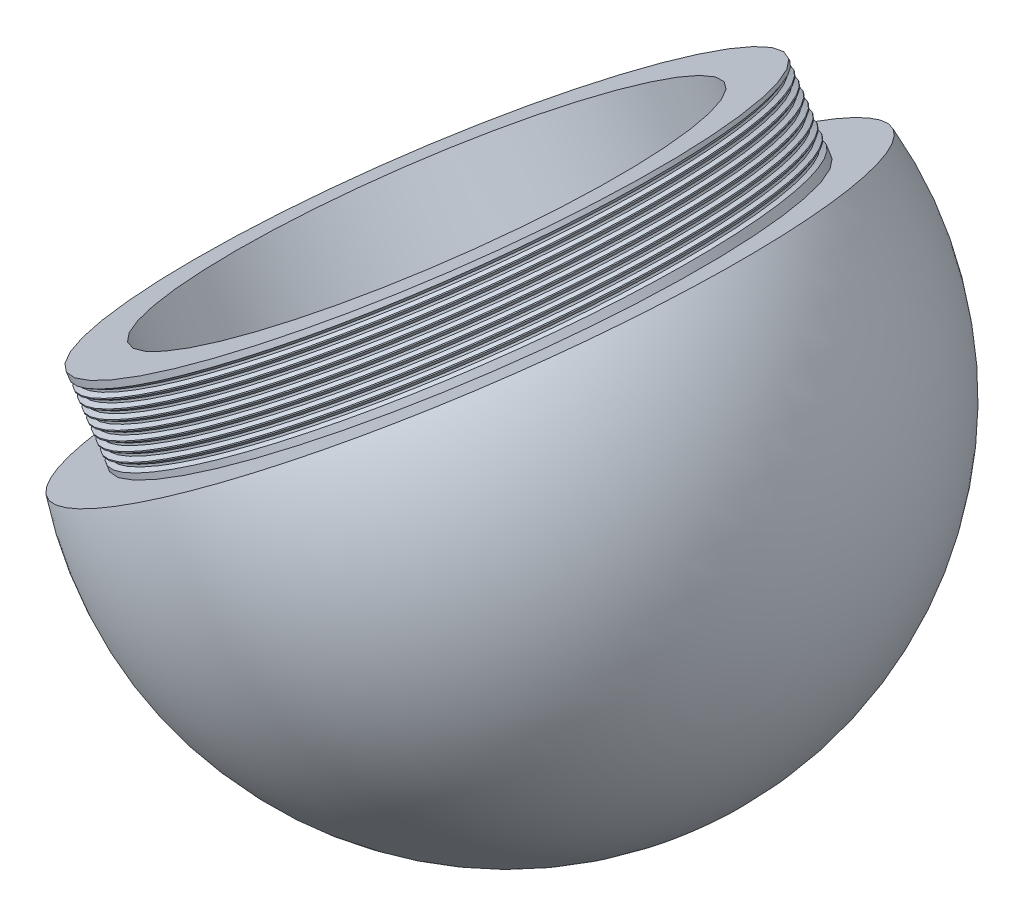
SolidWorks part; units mm, degrees
ref_plane "Płaszczyzna przednia" through (0, 0, 0) normal (0, 0, 1) x (1, 0, 0)
ref_plane "Płaszczyzna górna" through (0, 0, 0) normal (0, 1, 0) x (1, 0, 0)
ref_plane "Płaszczyzna prawa" through (0, 0, 0) normal (1, 0, 0) x (0, 0, -1)
sketch "Szkic1" plane through (0, 0, 0) normal (0, 0, 1) x (1, 0, 0)
  line L0 (35.1495, 35.56) -> (-46.2741, -18.9395)
  line L1 (-27.8116, 41.5513) -> (0, 0) construction
  line L2 (0, 0) -> (43.6504, -65.2148) construction
  line L3 (0, 50) -> (0, -60.8615) construction
  circle A0 centre (0, 0) radius 50
  point P8 (-27.8116, 41.5513)
  dimension "D1" = 100
  dimension "D2" = 40
  dimension "D3" = 38
sketch "Szkic3" plane through (0, 0, 0) normal (0, 0, 1) x (1, 0, 0)
  line L0 (-27.8116, 41.5513) -> (0, 0) construction
  line L3 (-27.8116, 41.5513) -> (0, 0) construction
  line L4 (35.1495, 35.56) -> (29.1921, 31.5725)
  line L5 (35.1495, 35.56) -> (-46.2741, -18.9395) construction
  line L6 (29.1921, 31.5725) -> (22.6945, 41.28)
  line L7 (22.6945, 41.28) -> (-10.0413, 41.8111)
  line L8 (-10.0413, 41.8111) -> (-23.918, 35.7341)
  line L9 (-27.8116, 41.5513) -> (-23.918, 35.7341)
  circle A0 centre (0, 0) radius 50 construction
  arc A1 (35.1495, 35.56) -> (-27.8116, 41.5513) centre (0, 0) ccw
sketch "Szkic4" plane through (0, 0, 0) normal (0, 0, 1) x (1, 0, 0)
  line L0 (0, 49.305) -> (6.9806, 49.305)
  line L1 (0, 50) -> (0, -60.8615) construction
  line L2 (6.9806, 49.305) -> (6.9806, 78.7656)
  line L3 (6.9806, 78.7656) -> (0, 78.7656)
  line L4 (0, 78.7656) -> (0, 49.305)
sketch "Szkic8" plane through (0, 0, 0) normal (0, 0, 1) x (1, 0, 0)
  line L0 (35.1495, 35.56) -> (-46.2741, -18.9395) construction
  line L1 (0, 0) -> (43.6504, -65.2148) construction
  line L2 (-27.8116, 41.5513) -> (0, 0) construction
  line L3 (35.1495, 35.56) -> (29.1921, 31.5725)
  line L4 (0, 0) -> (43.6504, -65.2148) construction
  line L5 (-27.8116, 41.5513) -> (0, 0) construction
  line L6 (29.1921, 31.5725) -> (22.6945, 41.28)
  line L7 (22.6945, 41.28) -> (16.6797, 37.2541)
  line L8 (16.6797, 37.2541) -> (23.1773, 27.5466)
  line L9 (20.0244, -29.917) -> (27.8116, -41.5513)
  circle A0 centre (0, 0) radius 50 construction
  arc A1 (27.8116, -41.5513) -> (35.1495, 35.56) centre (0, 0) ccw
  arc A3 (20.0244, -29.917) -> (23.1773, 27.5466) centre (0, 0) ccw
  circle A4 centre (0, 0) radius 36 construction
  circle A5 centre (0, 0) radius 50 construction
  dimension "D1" = 14
revolve "Obrót3" add sketch "Szkic8" angle 360 about L4
thread "Gwint2" pitch 1.25 start angle 0, offset 0, length 10, pitch 1.25, diameter 83.6421
ref_plane "Płaszczyzna2" through (-46.8143, -5.2445, 0) normal (0, 0, 1) x (-0.831, -0.5562, 0)
sketch "Profil gwintu2" plane through (-46.8143, -5.2445, 0) normal (0, 0, 1) x (-0.831, -0.5562, 0)
  line L0 (0, 0) -> (0, 1.25) construction
  line L11 (0, 0) -> (0, 1.0937)
  line L12 (0, 1.0937) -> (-0.6766, 0.7031)
  line L13 (-0.6766, 0.7031) -> (-0.6766, 0.3906)
  line L15 (-0.6766, 0.3906) -> (0, 0)
  line L17 (-0.6766, 0.5469) -> (0, 0.5469) construction
  point P2 (0, 0)
  dimension "Pitch" = 1.25
  dimension "Profile_Angle" = 60
  dimension "Profile_Land" = 0.3125
  dimension "Profile_Height" = 0.6766
